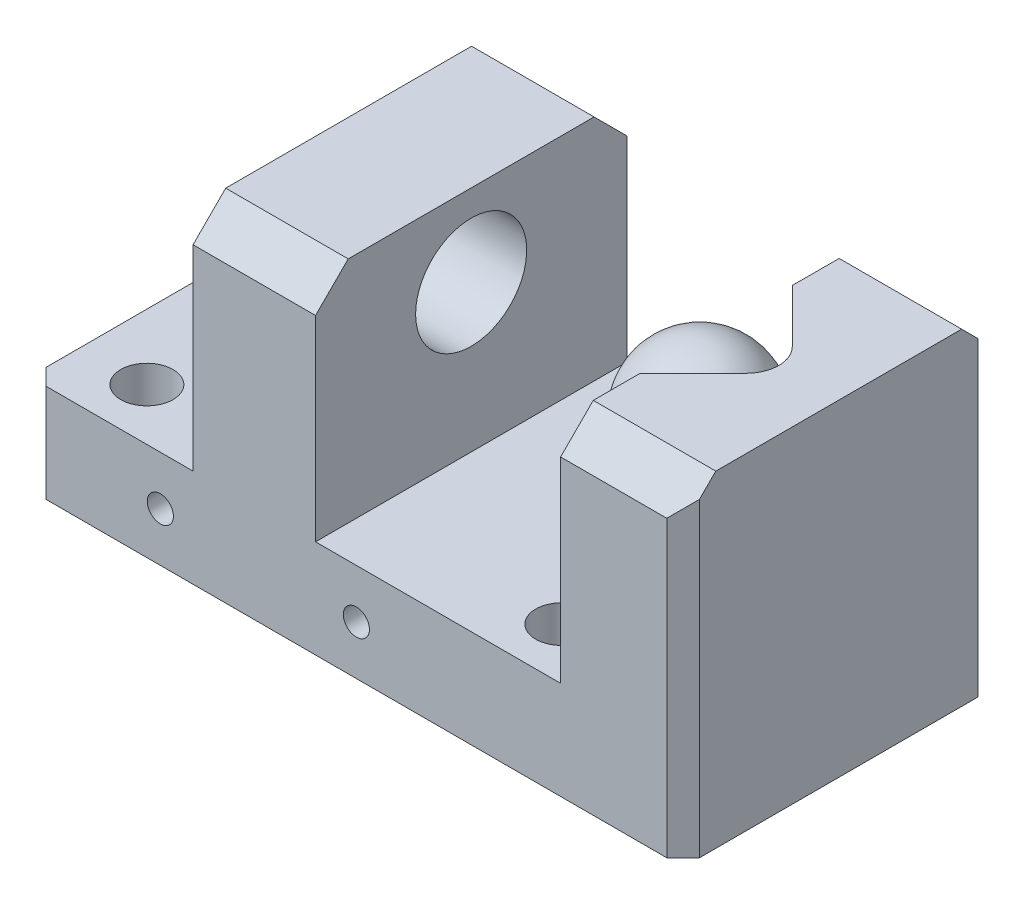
SolidWorks part; units mm, degrees
ref_plane "Plan1" through (0, 0, 0) normal (0, 0, 1) x (1, 0, 0)
ref_plane "Plan2" through (0, 0, 0) normal (0, 1, 0) x (1, 0, 0)
ref_plane "Plan3" through (0, 0, 0) normal (1, 0, 0) x (0, 0, -1)
sketch "Esquisse1" plane through (0, 0, 0) normal (0, 0, 1) x (1, 0, 0)
  line L0 (0, 6) -> (0, 0)
  line L1 (0, 0) -> (40, 0)
  line L3 (40, 20) -> (32.5, 20)
  line L4 (32.5, 20) -> (32.5, 6)
  line L5 (32.5, 6) -> (17.5, 6)
  line L6 (17.5, 6) -> (17.5, 20)
  line L7 (17.5, 20) -> (10, 20)
  line L8 (55, 0) -> (-55, 0) construction
  line L9 (0, -55) -> (0, 55) construction
  line L10 (40, 20) -> (40, 0)
  line L12 (10, 20) -> (10, 6)
  line L13 (10, 6) -> (0, 6)
  line L14 (25, 31.096) -> (25, -4.6843) construction
  dimension "D1" = 10
  dimension "D2" = 6
  dimension "D3" = 20
  dimension "D4" = 30
  dimension "D5" = 15
extrude "Boss.-Extru.1" add sketch "Esquisse1" along normal mid plane 19.05
hole_wizard "Diamètre du perçage Ø3.2 (3.2)1" positions "Esquisse4" profile "Esquisse3" hole size "Ø3.2" standard "ISO"
sketch "Esquisse4" plane through (0, 0, 0) normal (0, -1, 0) x (-1, 0, 0)
  line L0 (5.2428, 0) -> (-52.9112, 0) construction
  line L2 (-11, 0) -> (11, 0) construction
  line L3 (0, -9.525) -> (0, 9.525) construction
  point P0 (-4, 6.35)
  point P2 (-29.4, 6.35)
  point P12 (-4, -6.35)
  point P13 (-29.4, -6.35)
  dimension "D1" = 12.7
  dimension "D2" = 25.4
  dimension "D3" = 4
sketch "Esquisse3" plane through (4, 0, -6.35) normal (1, 0, 0) x (0, 0, -1)
  line L0 (0, 0) -> (0, 20)
  line L1 (0, 20) -> (1.6, 20)
  line L2 (1.6, 20) -> (1.6, 0)
  line L5 (1.6, 0) -> (0, 0)
  line L11 (0, -6.35) -> (0, 107.95) construction
  dimension "Diamètre du perçage jusqu'au prochain" = 3.2
  dimension "Profondeur du perçage jusqu'au prochain" = 20
ref_plane "Plan4" through (0, 15, 0) normal (0, 1, 0) x (1, 0, 0)
sketch "Esquisse5" plane through (0, 15, 0) normal (0, 1, 0) x (1, 0, 0)
  line L0 (-11, 0) -> (11, 0) construction
  line L1 (32.5, 4.6569) -> (32.5, -4.6569)
  line L2 (32.5, -4.6569) -> (35.7426, -1.4142)
  line L3 (35.7426, 1.4142) -> (32.5, 4.6569)
  line L4 (20.4276, 0) -> (45.7374, 0) construction
  line L5 (32.5, -9.525) -> (32.5, 9.525) construction
  circle A0 centre (31.5, 0) radius 4 construction
  arc A1 (35.7426, -1.4142) -> (35.7426, 1.4142) centre (34.3284, 0) ccw
  dimension "D1" = 8
  dimension "D2" = 1
  dimension "D4" = 2
  dimension "D3" = 90
extrude "Enlèv. mat.-Extru.1" cut sketch "Esquisse5" against normal blind 5 and the other way blind 10
sketch "Esquisse6" plane through (0, 15, 0) normal (0, 1, 0) x (1, 0, 0)
  line L0 (20.4276, 0) -> (45.7374, 0) construction
  line L1 (27.5, 0) -> (35.5, 0)
  circle A0 centre (31.5, 0) radius 4 construction
  arc A1 (35.5, 0) -> (27.5, 0) centre (31.5, 0) ccw
revolve "Révolution1" add sketch "Esquisse6" angle 360 about L1
hole_wizard "Trou taraudé M81" positions "Esquisse8" profile "Esquisse7" tap size "M8" standard "ISO"
sketch "Esquisse8" plane through (10, 0, 0) normal (-1, 0, 0) x (0, 0, 1)
  line L0 (0, -11) -> (0, 11) construction
  line L1 (8.25, 15) -> (-8.25, 15) construction
  point P0 (0, 15)
sketch "Esquisse7" plane through (10, 15, 0) normal (0, 1, 0) x (0, 0, 1)
  line L0 (0, 0) -> (0, 24.2929)
  line L1 (0, 24.2929) -> (3.4, 22.25)
  line L2 (3.4, 22.25) -> (3.4, 0)
  line L5 (3.4, 0) -> (0, 0)
  line L10 (0, 24.2929) -> (-3.4, 22.25) construction
  line L11 (0, -6.35) -> (0, 107.95) construction
  dimension "Diamètre du trou pour taraudage" = 6.8
  dimension "Profondeur du trou pour taraudage" = 22.25
  dimension "Angle de pointe" = 118
chamfer "Chanfrein1" distance 2 angle 45 4 edges at (36.25, 20, 9.525) (36.25, 20, -9.525) (13.75, 20, 9.525) (13.75, 20, -9.525)
chamfer "Chanfrein2" distance 1 angle 45 2 edges at (0, 3, 9.525) (0, 3, -9.525)
chamfer "Chanfrein3" distance 1 angle 45 2 edges at (40, 9, -9.525) (40, 9, 9.525)
hole_wizard "Trou taraudé M21" positions "Esquisse10" profile "Esquisse9" tap size "M2" standard "ISO"
sketch "Esquisse10" plane through (0, 0, 9.525) normal (0, 0, 1) x (1, 0, 0)
  line L0 (0, -10.4775) -> (0, 10.4775) construction
  line L1 (10.4775, 0) -> (-10.4775, 0) construction
  point P0 (8, 3)
  point P2 (20, 3)
  dimension "D1" = 8
  dimension "D2" = 12
  dimension "D3" = 3
sketch "Esquisse9" plane through (8, 3, 9.525) normal (1, 0, 0) x (0, -1, 0)
  line L0 (0, 0) -> (0, 8.4807)
  line L1 (0, 8.4807) -> (0.8, 8)
  line L2 (0.8, 8) -> (0.8, 0)
  line L5 (0.8, 0) -> (0, 0)
  line L10 (0, 8.4807) -> (-0.8, 8) construction
  line L11 (0, -6.35) -> (0, 107.95) construction
  dimension "Diamètre du trou pour taraudage" = 1.6
  dimension "Profondeur du trou pour taraudage" = 8
  dimension "Angle de pointe" = 118
delete or keep bodies "Corps-Effacer/suppr1" [suppressed] type delete bodies bodies 104
